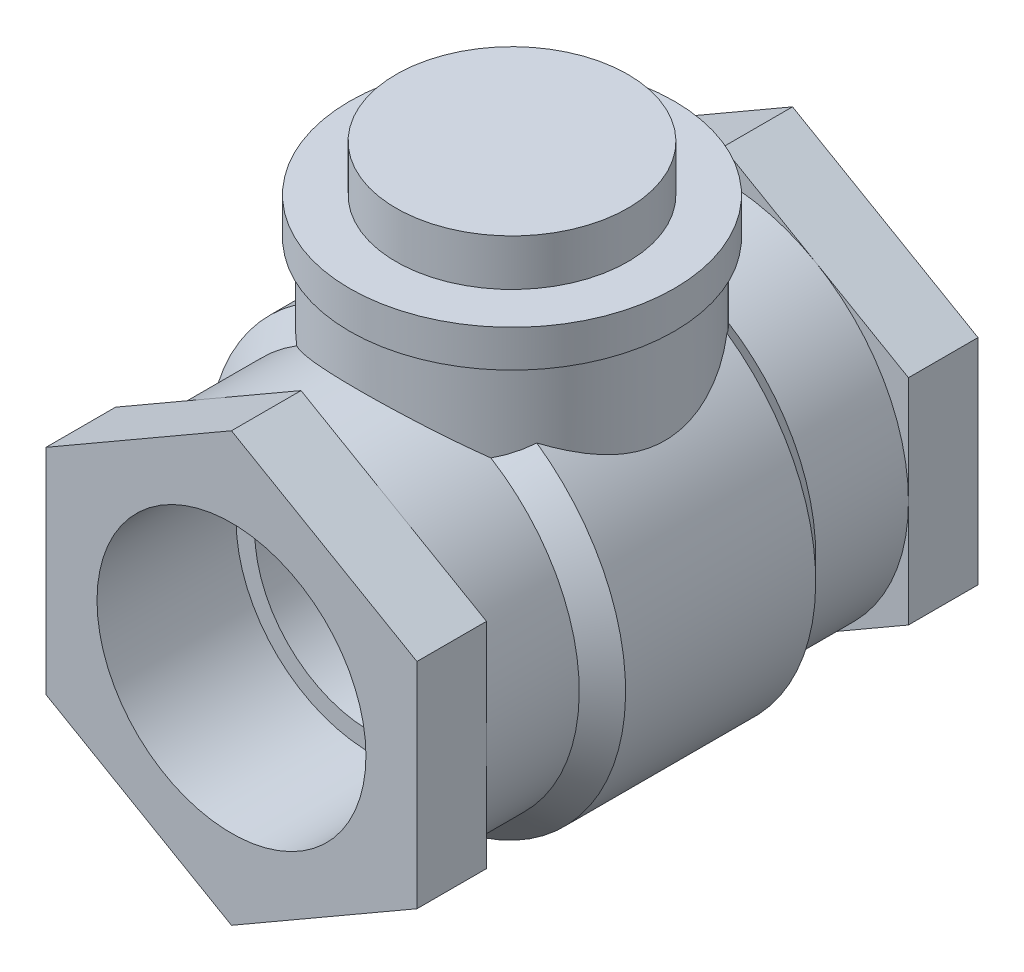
SolidWorks part; units mm, degrees
ref_plane "Plan1" through (0, 0, 0) normal (0, 0, 1) x (1, 0, 0)
ref_plane "Plan2" through (0, 0, 0) normal (0, 1, 0) x (1, 0, 0)
ref_plane "Plan3" through (0, 0, 0) normal (1, 0, 0) x (0, 0, -1)
sketch "Esquisse1" plane through (0, 0, 0) normal (0, 1, 0) x (1, 0, 0)
  line L0 (0, 91) -> (0, -91) construction
  line L1 (29, 60.5) -> (29, 30.5)
  line L2 (25, 30.5) -> (25, -30.5)
  line L3 (25, 30.5) -> (29, 30.5)
  line L4 (25, -30.5) -> (29, -30.5)
  line L5 (29, -30.5) -> (29, -60.5)
  line L6 (29, -60.5) -> (50, -60.5)
  line L7 (50, -60.5) -> (50, -45.5)
  line L8 (50, -45.5) -> (40, -45.5)
  line L9 (40, -45.5) -> (40, -25.5)
  line L10 (40, -25.5) -> (45, -20.5)
  line L11 (45, -20.5) -> (45, 20.5)
  line L12 (45, 20.5) -> (40, 25.5)
  line L13 (40, 25.5) -> (40, 45.5)
  line L14 (40, 45.5) -> (50, 45.5)
  line L15 (50, 45.5) -> (50, 60.5)
  line L16 (50, 60.5) -> (29, 60.5)
  dimension "D1" = 50
  dimension "D2" = 58
  dimension "D3" = 30
  dimension "D4" = 121
  dimension "D5" = 15
  dimension "D6" = 100
  dimension "D7" = 10
  dimension "D8" = 45
  dimension "D9" = 45
  dimension "D10" = 5
  dimension "D11" = 40
  dimension "D12" = 60.5
revolve "Révolution1" add sketch "Esquisse1" angle 360 about L0
sketch "Esquisse2" plane through (0, 0, 60.5) normal (0, 0, 1) x (1, 0, 0)
  line L1 (40, -23.094) -> (40, 23.094)
  line L2 (40, 23.094) -> (0, 46.188)
  line L3 (0, 46.188) -> (-40, 23.094)
  line L4 (-40, 23.094) -> (-40, -23.094)
  line L5 (-40, -23.094) -> (0, -46.188)
  line L6 (0, -46.188) -> (40, -23.094)
  circle A0 centre (0, 0) radius 40 construction
  dimension "D1" = 80
extrude "Enlèv. mat.-Extru.1" cut sketch "Esquisse2" against normal up to surface (15 mm away) flip side to cut
sketch "Esquisse3" plane through (0, 0, -60.5) normal (0, 0, -1) x (-1, 0, 0)
  line L1 (40, -23.094) -> (40, 23.094)
  line L2 (40, 23.094) -> (0, 46.188)
  line L3 (0, 46.188) -> (-40, 23.094)
  line L4 (-40, 23.094) -> (-40, -23.094)
  line L5 (-40, -23.094) -> (0, -46.188)
  line L6 (0, -46.188) -> (40, -23.094)
  circle A0 centre (0, 0) radius 40 construction
  dimension "D1" = 80
extrude "Enlèv. mat.-Extru.3" cut sketch "Esquisse3" against normal up to surface (15 mm away) flip side to cut
sketch "Esquisse4" plane through (0, 0, 0) normal (0, 0, 1) x (1, 0, 0)
  line L0 (0, 0) -> (0, 143.0315) construction
  line L1 (0, 70) -> (25, 70)
  line L2 (25, 70) -> (25, 60)
  line L3 (25, 60) -> (35, 60)
  line L4 (35, 60) -> (35, 52)
  line L5 (35, 52) -> (33, 52)
  line L6 (33, 52) -> (33, 30)
  line L8 (33, 30) -> (0, 30)
  line L9 (0, 30) -> (0, 70)
  dimension "D1" = 70
  dimension "D2" = 10
  dimension "D3" = 50
  dimension "D4" = 70
  dimension "D5" = 66
  dimension "D6" = 30
  dimension "D7" = 22
revolve "Révolution2" add sketch "Esquisse4" angle 360 about L0
